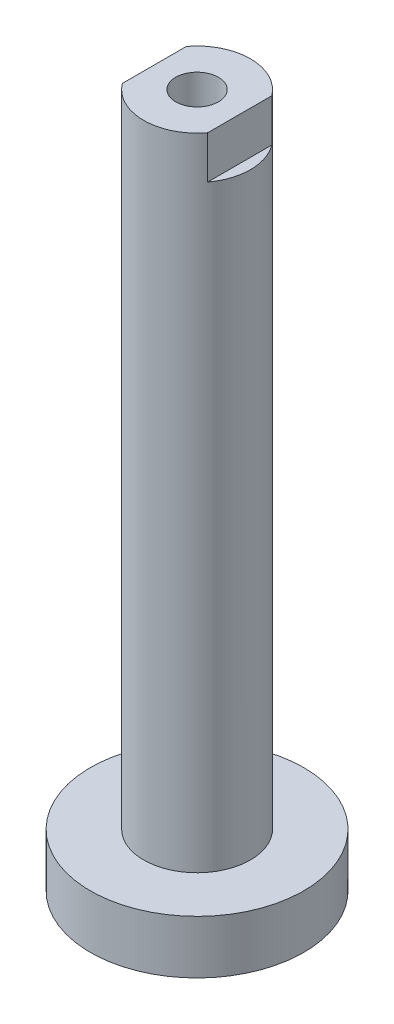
SolidWorks part; units mm, degrees
ref_plane "Front Plane" through (0, 0, 0) normal (0, 0, 1) x (1, 0, 0)
ref_plane "Top Plane" through (0, 0, 0) normal (0, 1, 0) x (1, 0, 0)
ref_plane "Right Plane" through (0, 0, 0) normal (1, 0, 0) x (0, 0, -1)
sketch "Sketch1" plane through (0, 0, 0) normal (1, 0, 0) x (0, 0, -1)
  line L0 (0, 0) -> (0, 50)
  line L1 (0, 50) -> (2, 50)
  line L2 (2, 50) -> (2, 60)
  line L3 (2, 60) -> (5, 60)
  line L4 (5, 60) -> (5, 0)
  line L5 (5, 0) -> (10, 0)
  line L6 (10, 0) -> (10, -5)
  line L7 (10, -5) -> (0, -5)
  line L8 (0, -5) -> (0, 0)
  dimension "D1" = 5
  dimension "D2" = 10
  dimension "D3" = 60
  dimension "D4" = 2
  dimension "D5" = 5
  dimension "D6" = 10
revolve "Revolve1" add sketch "Sketch1" angle 360 about L0
sketch "Sketch2" plane through (0, 60, 0) normal (0, 1, 0) x (1, 0, 0)
  line L1 (4, 5.8033) -> (-4, 5.8033)
  line L2 (4, 5.8033) -> (4, -5.8033)
  line L3 (4, -5.8033) -> (-4, -5.8033)
  line L4 (-4, 5.8033) -> (-4, -5.8033)
  line L5 (4, 5.8033) -> (-4, -5.8033) construction
  line L6 (4, -5.8033) -> (-4, 5.8033) construction
  point P0 (0, 0)
  dimension "D1" = 8
extrude "Cut-Extrude1" cut sketch "Sketch2" against normal blind 4 flip side to cut
